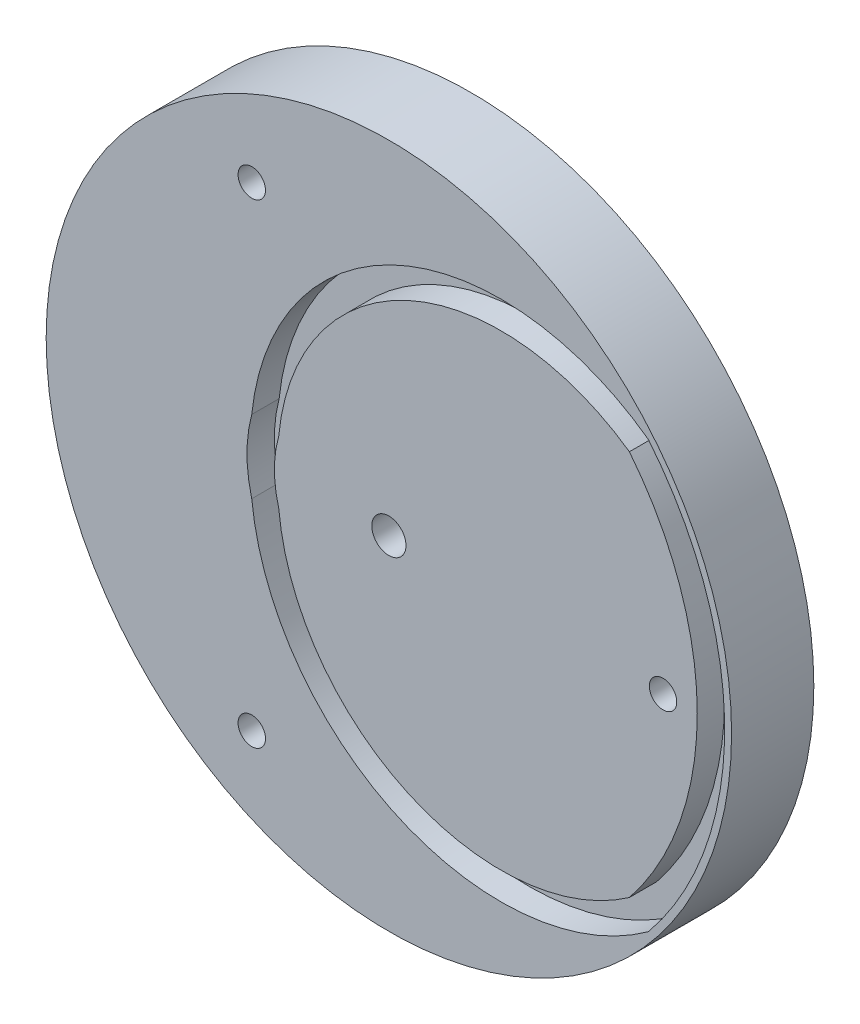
SolidWorks part; units mm, degrees
ref_plane "FRONT" through (0, 0, 0) normal (0, 0, 1) x (1, 0, 0)
ref_plane "TOP" through (0, 0, 0) normal (0, 1, 0) x (1, 0, 0)
ref_plane "RIGHT" through (0, 0, 0) normal (1, 0, 0) x (0, 0, -1)
sketch "Sketch4" plane through (0, 0, 0) normal (0, 0, 1) x (1, 0, 0)
  line L0 (-92.4732, 0) -> (115.1433, 0) construction
  arc A0 (74.5998, 0) -> (57.9022, 47.0369) centre (0, 0) ccw
  arc A1 (-29.6926, 0) -> (-28.6306, 7.87) centre (0, 0) cw
  arc A2 (57.9022, 47.0369) -> (-28.6306, 7.87) centre (25.9656, 2.422) ccw
  dimension "D1" = 74.5998
  dimension "D2" = 29.6926
  dimension "D3" = 54.8674
  dimension "D4" = 2.422
  dimension "D5" = 25.9656
sketch "Sketch5" plane through (0, 0, 0) normal (0, 1, 0) x (1, 0, 0)
  line L0 (74.5998, 0) -> (77.7743, 0)
  line L1 (77.7743, 0) -> (77.7743, 6.35)
  line L2 (77.7743, 6.35) -> (71.4243, 6.35)
  line L3 (71.4243, 6.35) -> (71.4243, 0)
  line L4 (71.4243, 0) -> (74.5998, 0)
  dimension "D1" = 6.35
  dimension "D2" = 3.1755
  dimension "D3" = 6.35
sketch "Sketch6" plane through (0, 0, 0) normal (0, 0, 1) x (1, 0, 0)
  line L0 (-88.2423, 0) -> (118.2888, 0) construction
  circle A0 centre (0, 0) radius 79.375
  dimension "D1" = 158.75
extrude "Base-Extrude" add sketch "Sketch6" against normal blind 19.05
sweep "Cut-Sweep1" cut profiles "Sketch5" path "Sketch4"
sketch "Sketch7" plane through (0, 0, 0) normal (0, 0, 1) x (1, 0, 0)
  line L0 (95.41, 0) -> (-100.917, 0) construction
mirror "Mirror2" about plane through (0, 0, 0) normal (0, 1, 0)
sketch "Sketch8" plane through (0, 0, 0) normal (0, 0, 1) x (1, 0, 0)
  circle A0 centre (0, 0) radius 3.9624
  dimension "D1" = 7.9248
extrude "Cut-Extrude1" cut sketch "Sketch8" against normal through all
sketch "Sketch9" plane through (0, 0, 0) normal (0, 0, 1) x (1, 0, 0)
  line L0 (95.41, 0) -> (-100.917, 0) construction
  circle A0 centre (63.5, 0) radius 3.175
  dimension "D1" = 6.35
  dimension "D2" = 63.5
extrude "Cut-Extrude2" cut sketch "Sketch9" against normal through all
pattern_circular "CirPattern1" count 3 every 120
